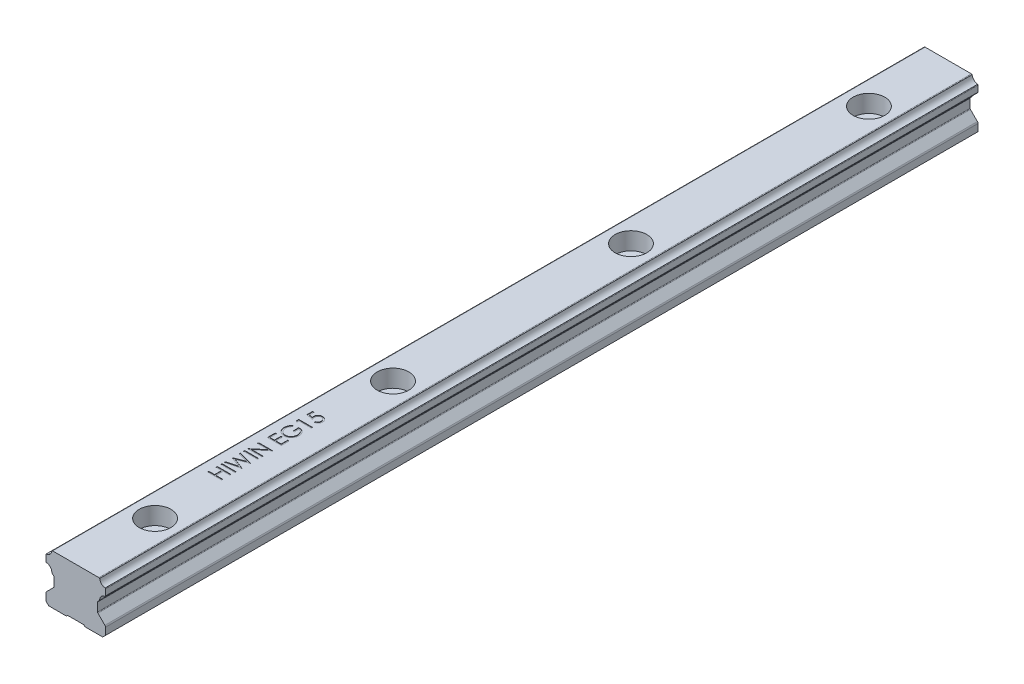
SolidWorks part; units mm, degrees
ref_plane "前视基准面" through (0, 0, 0) normal (0, 0, 1) x (1, 0, 0)
ref_plane "上视基准面" through (0, 0, 0) normal (0, 1, 0) x (1, 0, 0)
ref_plane "右视基准面" through (0, 0, 0) normal (1, 0, 0) x (0, 0, -1)
sketch "草图1" plane through (0, 0, 0) normal (0, 0, 1) x (1, 0, 0)
  line L1 (7.5, 9.3694) -> (7.5, 10.8306)
  line L2 (5.8306, 12.5) -> (-5.8306, 12.5)
  line L3 (-7.5, 10.8306) -> (-7.5, 9.3694)
  line L4 (-6.0294, 7.6356) -> (-5.5879, 7.1941)
  line L5 (-5.5, 6.982) -> (-5.5, 4.8243)
  line L6 (-5.5879, 4.6121) -> (-7.3536, 2.8464)
  line L7 (-7.5, 2.4929) -> (-7.5, 0.7)
  line L8 (-7.5, 0.7) -> (-6.8, 0)
  line L9 (-6.8, 0) -> (-2.35, 0)
  line L10 (-2.35, 0) -> (-2.05, 0.3)
  line L11 (-2.05, 0.3) -> (2.05, 0.3)
  line L12 (2.05, 0.3) -> (2.35, 0)
  line L13 (2.35, 0) -> (6.8, 0)
  line L14 (6.8, 0) -> (7.5, 0.7)
  line L15 (7.5, 0.7) -> (7.5, 2.4929)
  line L16 (7.3536, 2.8464) -> (5.5879, 4.6121)
  line L17 (5.5, 4.8243) -> (5.5, 6.982)
  line L18 (5.5879, 7.1941) -> (6.0294, 7.6356)
  line L19 (-2.35, 0) -> (2.35, 0) construction
  line L20 (0, 0) -> (0, 12.5) construction
  arc A0 (7.5, 10.8306) -> (7.4215, 11.0328) centre (7.2, 10.8306) ccw
  arc A1 (6.0328, 12.4215) -> (7.4215, 11.0328) centre (7.529, 12.529) ccw
  arc A2 (6.0328, 12.4215) -> (5.8306, 12.5) centre (5.8306, 12.2) ccw
  arc A3 (-5.8306, 12.5) -> (-6.0328, 12.4215) centre (-5.8306, 12.2) ccw
  arc A4 (-7.4215, 11.0328) -> (-6.0328, 12.4215) centre (-7.529, 12.529) ccw
  arc A5 (-7.4215, 11.0328) -> (-7.5, 10.8306) centre (-7.2, 10.8306) ccw
  arc A6 (-7.5, 9.3694) -> (-7.4215, 9.1672) centre (-7.2, 9.3694) ccw
  arc A7 (-6.0294, 7.6356) -> (-7.4215, 9.1672) centre (-7.529, 7.671) ccw
  arc A8 (-5.5, 6.982) -> (-5.5879, 7.1941) centre (-5.8, 6.982) ccw
  arc A9 (-5.5879, 4.6121) -> (-5.5, 4.8243) centre (-5.8, 4.8243) ccw
  arc A10 (-7.3536, 2.8464) -> (-7.5, 2.4929) centre (-7, 2.4929) ccw
  arc A11 (7.5, 2.4929) -> (7.3536, 2.8464) centre (7, 2.4929) ccw
  arc A12 (5.5, 4.8243) -> (5.5879, 4.6121) centre (5.8, 4.8243) ccw
  arc A13 (5.5879, 7.1941) -> (5.5, 6.982) centre (5.8, 6.982) ccw
  arc A14 (7.4215, 9.1672) -> (6.0294, 7.6356) centre (7.529, 7.671) ccw
  arc A15 (7.4215, 9.1672) -> (7.5, 9.3694) centre (7.2, 9.3694) ccw
extrude "凸台-拉伸1" add sketch "草图1" against normal blind 220
hole_wizard "M4 六角凹头螺钉的柱形沉头孔1" positions "草图3" profile "草图2" counterbore size "M4" standard "ISO"
sketch "草图3" plane through (1.3966, 12.5, 9.2217) normal (0, 1, 0) x (-1, 0, 0)
  point P0 (1.3966, -29.2217)
  dimension "D1" = 20
sketch "草图2" plane through (0, 12.5, -20) normal (1, 0, 0) x (0, 0, 1)
  line L0 (0, 0) -> (0, 12.5)
  line L1 (0, 12.5) -> (2.25, 12.5)
  line L3 (2.25, 12.5) -> (2.25, 4.4)
  line L4 (2.25, 4.4) -> (4, 4.4)
  line L5 (4, 4.4) -> (4, 0)
  line L7 (4, 0) -> (0, 0)
  line L11 (0, -6.35) -> (0, 107.95) construction
  dimension "通孔孔直径" = 4.5
  dimension "通孔孔深度" = 12.5
  dimension "柱形沉头孔直径" = 8
  dimension "柱形沉头孔深度" = 4.4
pattern_linear "阵列(线性)1" count 4 spacing 60 along (0, 0, -1) of "M4 六角凹头螺钉的柱形沉头孔1"
sketch "草图6" plane through (0, 12.5, 0) normal (0, 1, 0) x (1, 0, 0)
  line L0 (0, 20) -> (0, 80) construction
  text T0 "HIWIN EG15"
extrude "切除-拉伸1" cut sketch "草图6" against normal blind 0.1
equation "\"D1@凸台-拉伸1\" = 2 * \"D1@草图3\" + \"D3@阵列(线性)1\" *  ( \"D1@阵列(线性)1\"  - 1) "
